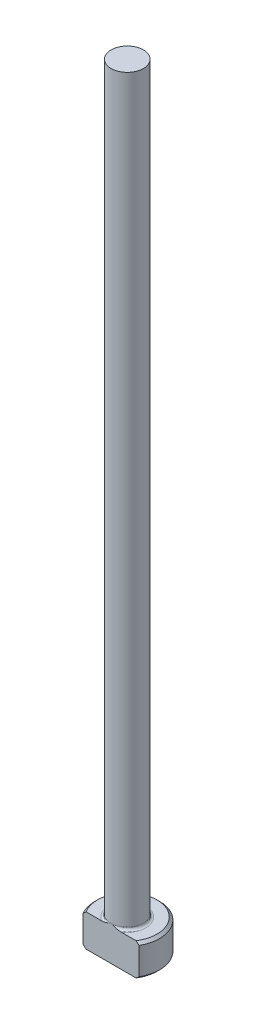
SolidWorks part; units mm, degrees
ref_plane "Front Plane" through (0, 0, 0) normal (0, 0, 1) x (1, 0, 0)
ref_plane "Top Plane" through (0, 0, 0) normal (0, 1, 0) x (1, 0, 0)
ref_plane "Right Plane" through (0, 0, 0) normal (1, 0, 0) x (0, 0, -1)
sketch "Sketch1" plane through (0, 0, 0) normal (0, 0, 1) x (1, 0, 0)
  line L0 (0, 259.9588) -> (0, -15.1925) construction
  line L1 (0, 0) -> (-3.175, 0)
  line L2 (-3.175, 0) -> (-3.175, 3.175)
  line L3 (-3.175, 3.175) -> (-1.5875, 3.175)
  line L4 (-1.5875, 3.175) -> (-1.5875, 76.2)
  line L5 (-1.5875, 76.2) -> (0, 76.2)
  line L6 (0, 76.2) -> (0, 0)
  dimension "L" = 76.2
  dimension "H" = 6.35
  dimension "T" = 3.175
  dimension "D" = 3.175
revolve "Revolve1" add sketch "Sketch1" angle 360 about L0
chamfer "Chamfer1" distance 0.254 angle 45 2 edges at (0, 3.175, 3.175) (0, 0, 3.175)
fillet "Fillet1" radius 0.254 1 edges at (0, 3.175, 1.5875)
sketch "Sketch2" plane through (0, 0, 0) normal (0, -1, 0) x (1, 0, 0)
  line L0 (-2.7496, 1.5875) -> (2.7496, 1.5875)
  arc A0 (2.7496, 1.5875) -> (-2.7496, 1.5875) centre (0, 0) ccw
  circle A1 centre (0, 0) radius 3.175 construction
  circle A3 centre (0, 0) radius 1.5875 construction
extrude "KEY" cut sketch "Sketch2" against normal through all
sketch "Pocket Sketch" plane through (0, 0, 0) normal (0, 0, 1) x (1, 0, 0)
  line L0 (-3.5719, 0) -> (-3.5719, 3.2004)
  line L1 (-3.5719, 3.2004) -> (-2.5479, 3.2004)
  line L2 (-1.7859, 3.9624) -> (-1.7859, 22.225)
  line L3 (-1.7859, 22.225) -> (0, 22.225)
  line L4 (0, 22.225) -> (0, 0)
  line L5 (0, 0) -> (-3.5719, 0)
  line L6 (0, 12.6104) -> (0, -2.4989) construction
  line L7 (-3.175, 2.921) -> (-3.175, 0.254) construction
  line L8 (2.921, 3.175) -> (-2.921, 3.175) construction
  line L9 (-1.5875, 76.2) -> (-1.5875, 3.429) construction
  line L10 (-2.5479, 3.2004) -> (-1.7859, 3.9624)
  point P3 (-1.7859, 3.2004)
  dimension "D1" = 7.1437
  dimension "D2" = 0.3969
  dimension "D3" = 0.0254
  dimension "D4" = 0.1984
  dimension "D5" = 3.5719
  dimension "D6" = 22.225
